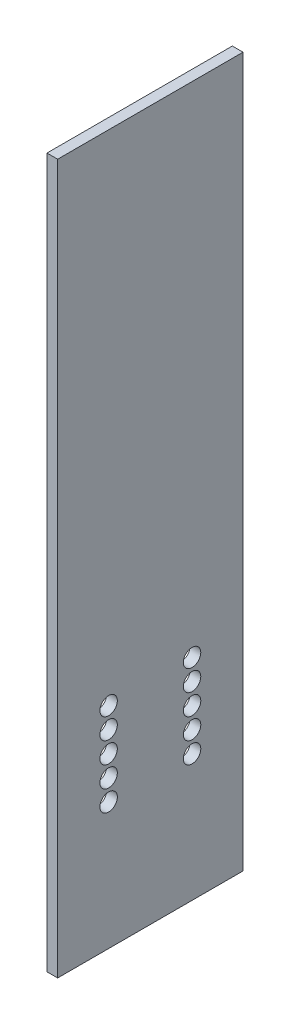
SolidWorks part; units mm, degrees
ref_plane "Front Plane" through (0, 0, 0) normal (0, 0, 1) x (1, 0, 0)
ref_plane "Top Plane" through (0, 0, 0) normal (0, 1, 0) x (1, 0, 0)
ref_plane "Right Plane" through (0, 0, 0) normal (1, 0, 0) x (0, 0, -1)
sketch "Sketch1" plane through (0, 0, 0) normal (1, 0, 0) x (0, 0, -1)
  line L1 (-28.2194, 143.51) -> (28.2194, 143.51)
  line L2 (-28.2194, 143.51) -> (-28.2194, -143.51)
  line L3 (-28.2194, -143.51) -> (28.2194, -143.51)
  line L4 (28.2194, 143.51) -> (28.2194, -143.51)
  line L5 (-28.2194, 143.51) -> (28.2194, -143.51) construction
  line L6 (-28.2194, -143.51) -> (28.2194, 143.51) construction
  point P0 (0, 0)
extrude "Boss-Extrude1" add sketch "Sketch1" along normal blind 3.2512
sketch "Sketch2" plane through (0, 0, 0) normal (-1, 0, 0) x (0, 0, 1)
  line L0 (0, 143.51) -> (0, -143.51) construction
  line L1 (-28.2194, 143.51) -> (28.2194, 143.51) construction
  line L2 (28.2194, -143.51) -> (-28.2194, -143.51) construction
  point P7 (-12.7, -98.5012)
  point P9 (12.7, -98.5012)
hole_wizard "#4 (0.209) Diameter Hole1" positions "Sketch3" profile "Sketch4" hole size "#4" standard "ANSI Inch"
sketch "Sketch3" plane through (0, 0, 0) normal (-1, 0, 0) x (0, 0, 1)
  point P0 (-12.7, -98.5012)
  point P3 (12.7, -98.5012)
sketch "Sketch4" plane through (0, -98.5012, -12.7) normal (0, 1, 0) x (0, 0, 1)
  line L0 (0, 0) -> (0, 3.2512)
  line L1 (0, 3.2512) -> (2.6543, 3.2512)
  line L2 (2.6543, 3.2512) -> (2.6543, 0)
  line L5 (2.6543, 0) -> (0, 0)
  line L11 (0, -6.35) -> (0, 107.95) construction
  dimension "Thru Hole Dia." = 5.3086
  dimension "Thru Hole Depth" = 3.2512
sketch "Sketch5" plane through (0, 0, 0) normal (-1, 0, 0) x (0, 0, 1)
  line L0 (28.2194, 143.51) -> (28.2194, -143.51) construction
  line L1 (-28.2194, 143.51) -> (28.2194, 143.51)
  line L2 (-28.2194, 143.51) -> (-28.2194, 72.39)
  line L3 (-28.2194, 72.39) -> (28.2194, 72.39)
  line L4 (28.2194, 143.51) -> (28.2194, 72.39)
  dimension "D1" = 71.12
extrude "Cut-Extrude1" cut sketch "Sketch5" against normal up to next
pattern_linear "LPattern1" count 4 spacing 6.35 along (0, 1, 0) count 2 spacing 6.35 along (0, -1, 0) of "#4 (0.209) Diameter Hole1"
equation "\"motor offset\"=6mm"
equation "\"thickness0.25\"=0.225in"
equation "\"thickness0.125\"=0.122in"
equation "\"thickness_acrylic0.1\"= 0.1in"
equation "\"D1@Sketch1\"=\"thickness_acrylic0.1\"+\"thickness0.125\"+2"
equation "\"D2@Sketch2\"=\"thickness0.125\"+0.5+1.15"
